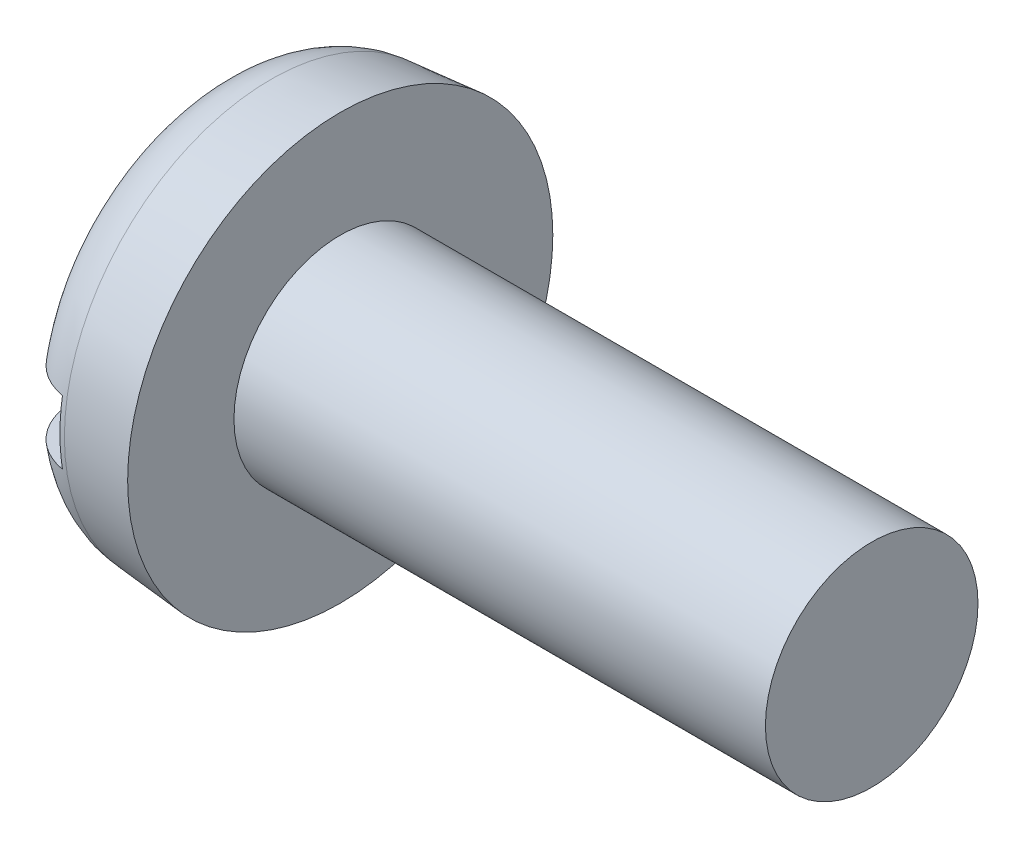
SolidWorks part; units mm, degrees
ref_plane "Plane1" through (0, 0, 0) normal (0, 0, 1) x (1, 0, 0)
ref_plane "Plane2" through (0, 0, 0) normal (0, 1, 0) x (1, 0, 0)
ref_plane "Plane3" through (0, 0, 0) normal (1, 0, 0) x (0, 0, -1)
sketch "BodySke" plane through (0, 0, 0) normal (0, 0, 1) x (1, 0, 0)
  line L0 (2.4, 2) -> (2.4, 4)
  line L1 (0, 0) -> (0, 3.79)
  line L2 (-25.4, 0) -> (127, 0) construction
  line L3 (12.4, 0) -> (0, 0)
  line L4 (2.4, 2) -> (12.4, 2)
  line L5 (12.4, 2) -> (12.4, 0)
  line L6 (0, 3.79) -> (2.4, 4)
  line L9 (3.1, 3.5875) -> (3.1, -5.9375) construction
  line L10 (2.4, 6.35) -> (2.4, -3.175) construction
revolve "Base-Revolve" add sketch "BodySke"
fillet "Fillet1" [suppressed] radius 0.2
fillet "Fillet2" radius 1.2 1 edges at (0, 0, 3.79)
sketch "Sketch2" plane through (0, 0, 0) normal (1, 0, 0) x (0, 0, -1)
  line L0 (4, -0.6) -> (-4, -0.6)
  line L1 (4, -0.6) -> (4, 0.6)
  line L2 (-4, 0.6) -> (4, 0.6)
  line L3 (-4, 0.6) -> (-4, -0.6)
extrude "Slot" cut sketch "Sketch2" along normal blind 1
sketch "ThdSchSke" plane through (0, 0, 0) normal (0, 0, 1) x (1, 0, 0)
  line L0 (3.8, -1.61) -> (3.5269, -2)
  line L1 (3.8, -1.61) -> (4.0731, -2)
  line L2 (4.0731, -2) -> (4.0731, -2.5)
  line L3 (-3.175, 0) -> (5.1513, 0) construction
  line L5 (4.0731, -2.5) -> (3.5269, -2.5)
  line L6 (3.5269, -2.5) -> (3.5269, -2)
revolve "ThreadSchematic" [suppressed] cut sketch "ThdSchSke" angle 360 about L3
pattern_linear "ThdSchPat" [suppressed]
equation "\"D1@Sketch2\" = \"Head_dia@BodySke\""
equation "\"D2@Sketch2\" = \"D1@Sketch2\" / 2"
equation "\"D3@Sketch2\" = \"Slot_width@Sketch2\" / 2"
equation "\"Thread_length@ThreadCosmetic\" = ((sgn( (\"Length@BodySke\" - \"Advance@BodySke\" * 2.0 ) - \"Thread_nom@BodySke\" )-1)*( (\"Length@BodySke\" - \"Advance@BodySke\"  * 2.0) - \"Thread_nom@BodySke\" ))/-2+ \"Thread_"
equation "\"Thread_minor@ThdSchSke\" = \"Thread_minor@ThreadCosmetic\""
equation "\"Diameter@ThdSchSke\" = \"Diameter@BodySke\""
equation "\"Overcut@ThdSchSke\" = \"Diameter@BodySke\" * 1.25"
equation "\"Start@ThdSchSke\" = \"Head_ht@BodySke\" + \"Length@BodySke\" - \"Thread_length@ThreadCosmetic\"  '---Non-countersunk---"
equation "\"Num_threads@ThdSchPat\" = int( \"Thread_length@ThreadCosmetic\" / \"Advance@BodySke\" + 0.999 )  + 1"
equation "\"Advance@ThdSchPat\" = \"Thread_length@ThreadCosmetic\" /  (\"Num_threads@ThdSchPat\" - 1) 'relax it"
